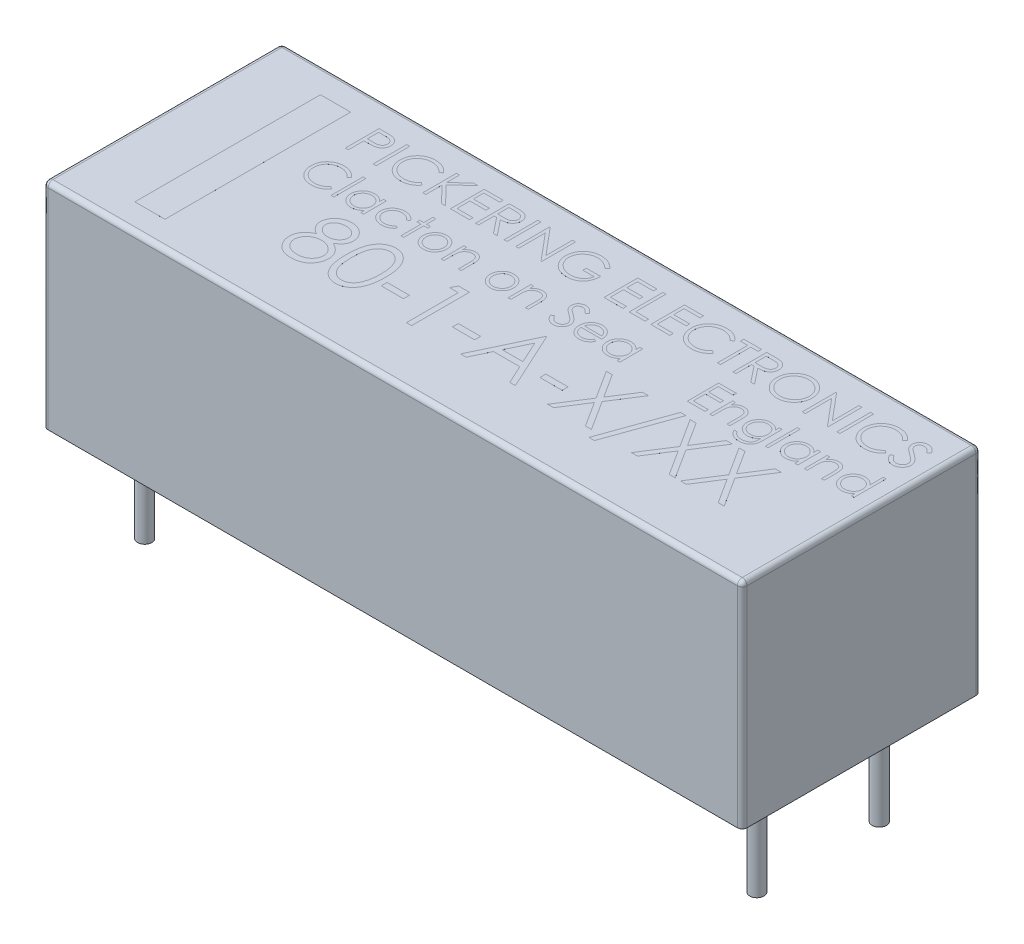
SolidWorks part; units mm, degrees
ref_plane "Front Plane" through (0, 0, 0) normal (0, 0, 1) x (1, 0, 0)
ref_plane "Top Plane" through (0, 0, 0) normal (0, 1, 0) x (1, 0, 0)
ref_plane "Right Plane" through (0, 0, 0) normal (1, 0, 0) x (0, 0, -1)
sketch "Sketch2" plane through (0, 0, 0) normal (0, 1, 0) x (1, 0, 0)
  line L1 (14.5, -4.95) -> (-14.5, -4.95)
  line L2 (14.5, -4.95) -> (14.5, 4.95)
  line L3 (14.5, 4.95) -> (-14.5, 4.95)
  line L4 (-14.5, -4.95) -> (-14.5, 4.95)
  line L5 (14.5, -4.95) -> (-14.5, 4.95) construction
  line L6 (14.5, 4.95) -> (-14.5, -4.95) construction
  point P0 (0, 0)
  dimension "D1" = 9.9
  dimension "D2" = 29
extrude "Main Body" add sketch "Sketch2" along normal blind 8.89 draft 0.023
sketch "Sketch3"
  dimension "D1" = 1.25
  dimension "D2" = 7.7
  dimension "D3" = 1.0965
  dimension "D4" = 2.7
  dimension "D5" = 1.4
  dimension "D6" = 2
extrude "Lettering" add sketch "Sketch3" along normal blind 0.0001
sketch "Sketch4" plane through (0, 0, 0) normal (0, -1, 0) x (1, 0, 0)
  line L0 (-14.5, -4.95) -> (-14.5, 4.95) construction
  line L1 (-12, 4.375) -> (-11.1, 4.375)
  line L2 (-12, 4.375) -> (-12, -4.375)
  line L3 (-12, -4.375) -> (-11.1, -4.375)
  line L4 (-11.1, 4.375) -> (-11.1, -4.375)
  line L5 (-14.5, 4.95) -> (14.5, 4.95) construction
  dimension "D1" = 8.75
  dimension "D2" = 0.9
  dimension "D3" = 2.5
  dimension "D4" = 0.575
extrude "Bobbin feet" add sketch "Sketch4" along normal blind 0.51
sketch "Sketch5" plane through (0, -0.51, 0) normal (0, -1, 0) x (1, 0, 0)
  line L0 (-11.1, -4.375) -> (-11.1, 4.375) construction
  line L1 (-11.1, -2.9375) -> (-12, -2.9375)
  line L2 (-11.1, -2.9375) -> (-11.1, -1.9375)
  line L3 (-11.1, -1.9375) -> (-12, -1.9375)
  line L4 (-12, -2.9375) -> (-12, -1.9375)
  line L5 (-12, 4.375) -> (-12, -4.375) construction
  line L6 (-12, 4.375) -> (-12, -4.375) construction
  line L7 (-12, -0.5) -> (-11.1, -0.5)
  line L8 (-12, -0.5) -> (-12, 0.5)
  line L9 (-12, 0.5) -> (-11.1, 0.5)
  line L10 (-11.1, -0.5) -> (-11.1, 0.5)
  line L11 (-11.1, 1.9375) -> (-12, 1.9375)
  line L12 (-11.1, 1.9375) -> (-11.1, 2.9375)
  line L13 (-11.1, 2.9375) -> (-12, 2.9375)
  line L14 (-12, 1.9375) -> (-12, 2.9375)
  line L15 (-12, -4.375) -> (-11.1, -4.375) construction
  dimension "D1" = 1.4375
  dimension "D2" = 1
  dimension "D3" = 1.4375
  dimension "D4" = 1
  dimension "D5" = 1
  dimension "D6" = 1.4375
extrude "Bobbin feet cut" cut sketch "Sketch5" against normal up to surface (0.51 mm away)
sketch "Sketch8" plane through (0, 0, 0) normal (0, -1, 0) x (1, 0, 0)
  line L0 (-14.5, -4.95) -> (-14.5, 4.95) construction
  line L1 (-12, -4.375) -> (-13.925, -4.375)
  line L2 (-12, -4.375) -> (-12, -2.9375)
  line L3 (-12, -2.9375) -> (-13.925, -2.9375)
  line L4 (-13.925, -4.375) -> (-13.925, -2.9375)
  line L5 (-12, -2.9375) -> (-11.1, -2.9375) construction
  dimension "D1" = 0.575
extrude "Extrude5" add sketch "Sketch8" along normal blind 0.1
pattern_linear "LPattern1" count 4 spacing 2.4385 along (0, 0, 1) of "Extrude5"
mirror "Mirror1" about plane through (0, 0, 0) normal (1, 0, 0) of "Extrude5", "Bobbin feet cut", "Bobbin feet", "LPattern1"
sketch "Sketch9" plane through (0, 0, 0) normal (0, -1, 0) x (1, 0, 0)
  line L0 (14.5, -4.95) -> (-14.5, -4.95) construction
  line L1 (14.5, 4.95) -> (14.5, -4.95) construction
  circle A0 centre (12.7, -2.54) radius 0.3
  circle A1 centre (12.7, 2.54) radius 0.2963
  dimension "D1" = 0.6
  dimension "D2" = 2.41
  dimension "D3" = 5.08
  dimension "D4" = 1.8
extrude "Pins" add sketch "Sketch9" along normal blind 4.31
mirror "Mirror2" about plane through (0, 0, 0) normal (1, 0, 0) of "Pins"
fillet "Fillet1" radius 0.2 8 edges at (-14.4983, 4.445, -4.9483) (14.4983, 4.445, -4.9483) (14.4983, 4.445, 4.9483) (-14.4983, 4.445, 4.9483) (14.4965, 8.89, 0) (0, 8.89, -4.9465) (-14.4965, 8.89, 0) (0, 8.89, 4.9465)
